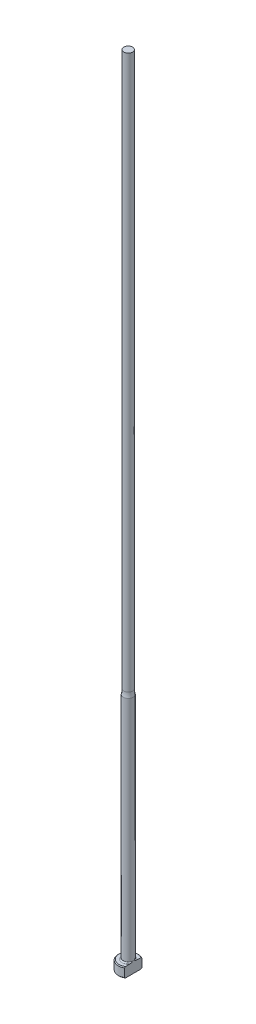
SolidWorks part; units mm, degrees
ref_plane "Front Plane" through (0, 0, 0) normal (0, 0, 1) x (1, 0, 0)
ref_plane "Top Plane" through (0, 0, 0) normal (0, 1, 0) x (1, 0, 0)
ref_plane "Right Plane" through (0, 0, 0) normal (1, 0, 0) x (0, 0, -1)
sketch "Sketch1" plane through (0, 0, 0) normal (0, 0, 1) x (1, 0, 0)
  line L0 (0, 259.9588) -> (0, -15.1925) construction
  line L1 (0, 0) -> (-3.175, 0)
  line L2 (-3.175, 0) -> (-3.175, 3.175)
  line L3 (-3.175, 3.175) -> (-1.5875, 3.175)
  line L4 (-1.3881, 77.7788) -> (-1.3881, 254)
  line L5 (-1.3881, 254) -> (0, 254)
  line L6 (0, 254) -> (0, 0)
  line L7 (-1.5875, 3.175) -> (-1.5875, 76.2)
  arc A0 (-1.5875, 76.2) -> (-1.3881, 77.7788) centre (-7.7381, 77.7788) ccw
  point P13 (-1.5875, 0)
  dimension "D1" = 6.35
  dimension "L" = 254
  dimension "D2" = 3.175
  dimension "H" = 6.35
  dimension "T" = 3.175
  dimension "D" = 2.7762
  dimension "S" = 76.2
revolve "Revolve1" add sketch "Sketch1" angle 360 about L0
chamfer "Chamfer1" distance 0.254 angle 45 2 edges at (0, 3.175, 3.175) (0, 0, 3.175)
fillet "Fillet1" radius 0.381 1 edges at (0, 3.175, 1.5875)
sketch "Sketch2" plane through (0, 0, 0) normal (0, 1, 0) x (1, 0, 0)
  line L0 (1.5875, -2.7496) -> (1.5875, 2.7496)
  circle A0 centre (0, 0) radius 3.175 construction
  arc A2 (1.5875, -2.7496) -> (1.5875, 2.7496) centre (0, 0) ccw
  circle A3 centre (0, 0) radius 3.175 construction
  circle A4 centre (0, 0) radius 1.5875 construction
extrude "Key Head" cut sketch "Sketch2" along normal up to next
